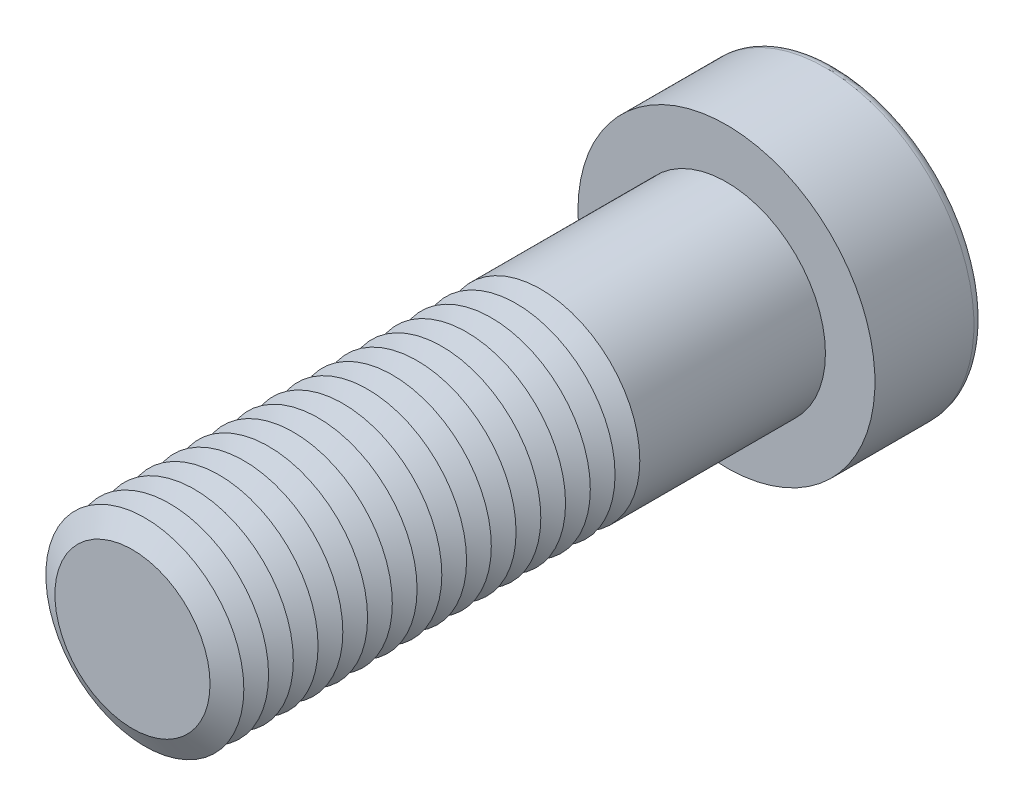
SolidWorks part; units mm, degrees
ref_plane "Front Plane" through (0, 0, 0) normal (0, 0, 1) x (1, 0, 0)
ref_plane "Top Plane" through (0, 0, 0) normal (0, 1, 0) x (1, 0, 0)
ref_plane "Right Plane" through (0, 0, 0) normal (1, 0, 0) x (0, 0, -1)
sketch "Sketch1" plane through (0, 0, 0) normal (0, 0, 1) x (1, 0, 0)
  circle A0 centre (0, 0) radius 10
  dimension "D1" = 20
extrude "Boss-Extrude1" add sketch "Sketch1" along normal blind 60
sketch "Sketch2" plane through (0, 0, 0) normal (0, 0, -1) x (-1, 0, 0)
  circle A0 centre (0, 0) radius 15
  dimension "D1" = 30
extrude "Boss-Extrude2" add sketch "Sketch2" along normal blind 11
sketch "Sketch3" plane through (0, 0, -11) normal (0, 0, -1) x (-1, 0, 0)
  line L1 (-4.0415, 7) -> (-8.0829, 0)
  line L2 (-8.0829, 0) -> (-4.0415, -7)
  line L3 (-4.0415, -7) -> (4.0415, -7)
  line L4 (4.0415, -7) -> (8.0829, 0)
  line L5 (8.0829, 0) -> (4.0415, 7)
  line L6 (4.0415, 7) -> (-4.0415, 7)
  circle A0 centre (0, 0) radius 7 construction
  dimension "D1" = 14
extrude "Cut-Extrude1" cut sketch "Sketch3" against normal blind 10.5
fillet "Fillet1" radius 1 1 edges at (-15, 0, -11)
sketch "Sketch4" plane through (0, 0, -0.5) normal (0, 0, -1) x (-1, 0, 0)
  line L0 (4.0415, -7) -> (8.0829, 0) construction
  circle A0 centre (0, 0) radius 7
extrude "Cut-Extrude2" cut sketch "Sketch4" against normal through all draft 60
sketch "Sketch5" plane through (0, 0, -11) normal (0, 0, -1) x (-1, 0, 0)
  circle A0 centre (0, 0) radius 8.0829
extrude "Cut-Extrude3" cut sketch "Sketch5" against normal through all draft 75
sketch "Sketch7" plane through (0, 0, 0) normal (1, 0, 0) x (0, 0, -1)
  line L25 (-60, 7.8349) -> (-58.75, 10)
  line L26 (-60, 10) -> (-60, -10) construction
  line L27 (-58.75, 10) -> (-61.25, 10)
  line L28 (-61.25, 10) -> (-60, 7.8349)
  line L29 (0, 10) -> (-60, 10) construction
  dimension "D1" = 2.5
revolve "Cut-Revolve1" cut sketch "Sketch7" angle 360 about axis through (0, 0, 60) along (0, 0, -1)
pattern_linear "LPattern1" count 17 spacing 2.5 along (0, 0, -1) of "Cut-Revolve1"
